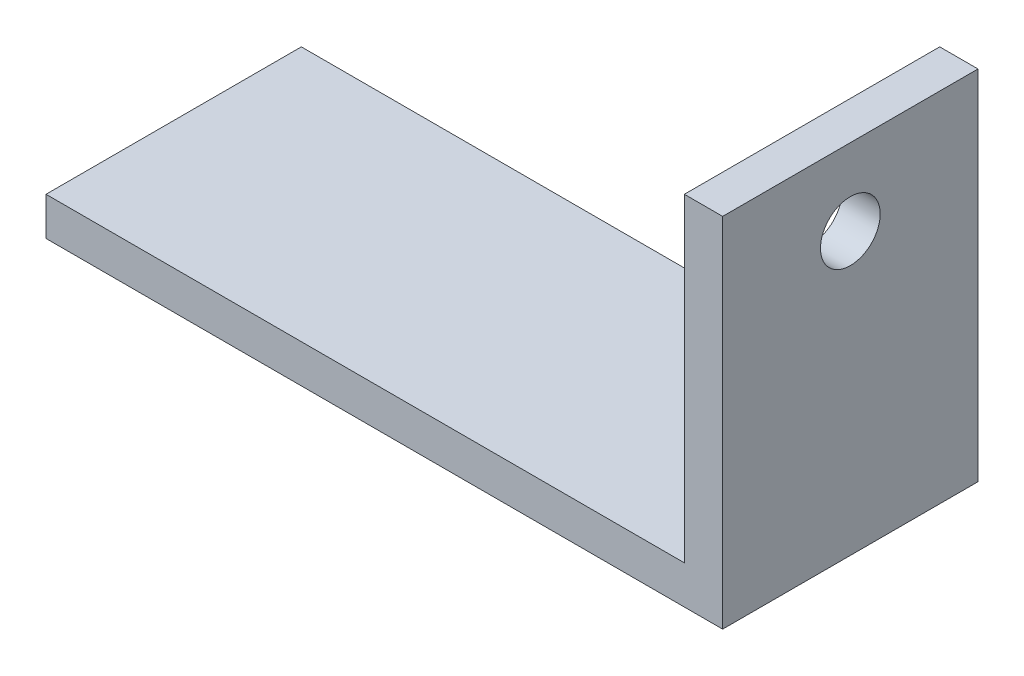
SolidWorks part; units mm, degrees
ref_plane "Front Plane" through (0, 0, 0) normal (0, 0, 1) x (1, 0, 0)
ref_plane "Top Plane" through (0, 0, 0) normal (0, 1, 0) x (1, 0, 0)
ref_plane "Right Plane" through (0, 0, 0) normal (1, 0, 0) x (0, 0, -1)
sketch "Sketch1" plane through (0, 0, 0) normal (0, 0, 1) x (1, 0, 0)
  line L0 (0, 0) -> (0, -25)
  line L1 (0, -25) -> (-50, -25)
  line L2 (3, 0) -> (3, -28)
  line L3 (3, -28) -> (-50, -28)
  line L4 (-50, -25) -> (-50, -28)
  line L5 (0, 0) -> (3, 0)
  dimension "D1" = 3
  dimension "D2" = 28
extrude "Boss-Extrude1" add sketch "Sketch1" along normal blind 20
sketch "Sketch2" plane through (3, 0, 0) normal (1, 0, 0) x (0, 0, -1)
  line L0 (-20, 0) -> (0, 0) construction
  circle A0 centre (-10, -6) radius 2.34
  dimension "D1" = 4.68
  dimension "D2" = 6
extrude "Cut-Extrude1" cut sketch "Sketch2" against normal blind 20
